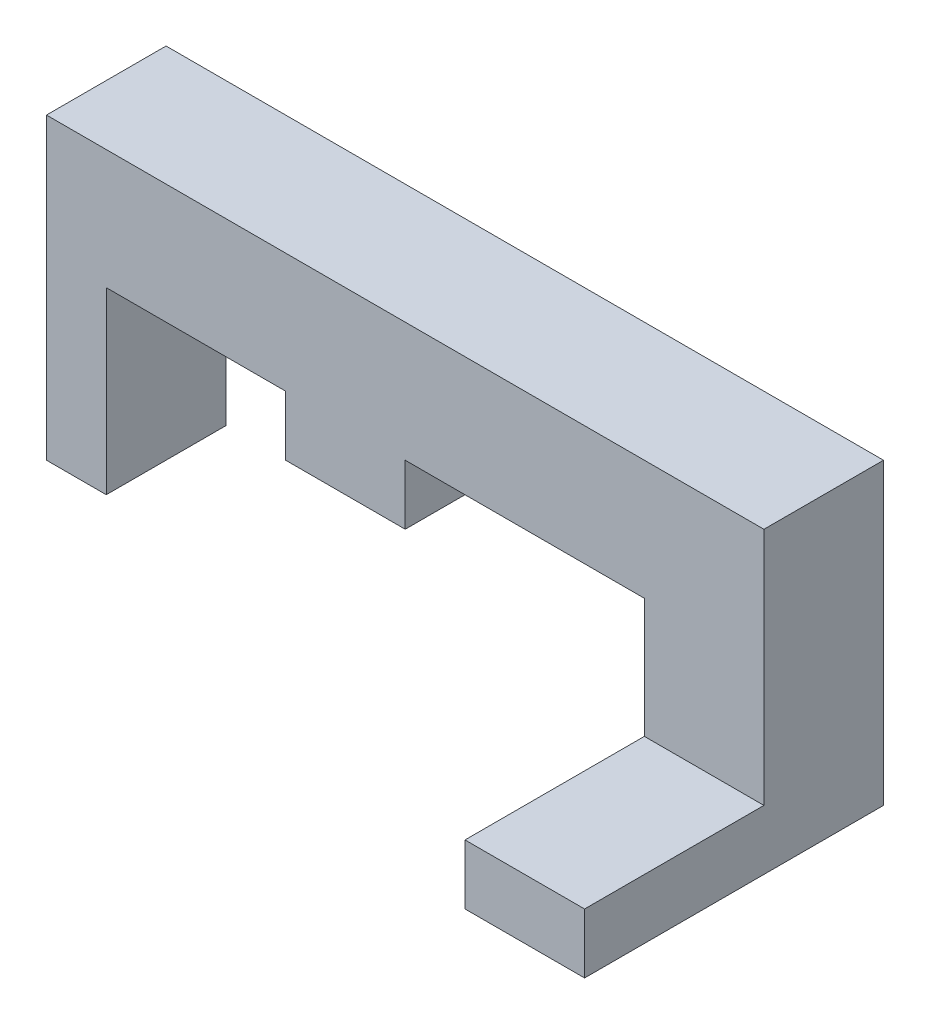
SolidWorks part; units mm, degrees
ref_plane "Alzado" through (0, 0, 0) normal (0, 0, 1) x (1, 0, 0)
ref_plane "Planta" through (0, 0, 0) normal (0, 1, 0) x (1, 0, 0)
ref_plane "Vista lateral" through (0, 0, 0) normal (1, 0, 0) x (0, 0, -1)
sketch "Croquis1" plane through (0, 0, 0) normal (0, 0, 1) x (1, 0, 0)
  line L0 (60, 25) -> (-60, -25) construction
  line L1 (-60, 25) -> (60, 25)
  line L2 (-60, 25) -> (-60, -25)
  line L3 (-60, -25) -> (60, -25)
  line L4 (60, 25) -> (60, -25)
  line L5 (60, -25) -> (-60, 25) construction
  dimension "D1" = 50
  dimension "D2" = 120
extrude "Saliente-Extruir1" add sketch "Croquis1" along normal mid plane 50
sketch "Croquis7" plane through (60, 0, 0) normal (1, 0, 0) x (0, 0, -1)
  line L0 (-25, -25) -> (25, -25) construction
  line L1 (-25, 25) -> (5, 25)
  line L2 (-25, 25) -> (-25, -15)
  line L3 (-25, -15) -> (5, -15)
  line L4 (5, 25) -> (5, -15)
  line L5 (25, -25) -> (25, 25) construction
  dimension "D1" = 10
  dimension "D2" = 20
extrude "Cortar-Extruir6" cut sketch "Croquis7" against normal through all
sketch "Croquis8" plane through (0, 0, -25) normal (0, 0, -1) x (-1, 0, 0)
  line L0 (50, -25) -> (50, 5)
  line L1 (60, -25) -> (-60, -25) construction
  line L2 (50, 5) -> (20, 5)
  line L3 (20, 5) -> (20, -5)
  line L4 (20, -5) -> (0, -5)
  line L5 (0, -5) -> (0, 5)
  line L6 (0, 5) -> (-40, 5)
  line L7 (-40, 5) -> (-40, -25)
  line L8 (-40, -25) -> (50, -25)
  line L9 (60, -15) -> (60, -25) construction
  dimension "D1" = 10
  dimension "D2" = 30
  dimension "D3" = 20
  dimension "D4" = 40
  dimension "D5" = 10
  dimension "D6" = 30
extrude "Cortar-Extruir7" cut sketch "Croquis8" against normal through all
sketch "Croquis9" plane through (0, -15, 0) normal (0, 1, 0) x (1, 0, 0)
  line L4 (-60, -25) -> (-50, -25)
  line L5 (-50, -25) -> (-50, 5)
  line L6 (-50, 5) -> (-60, 5)
  line L7 (-60, 5) -> (-60, -25)
  line L8 (-60, -25) -> (-50, -25)
  line L9 (-50, -25) -> (-50, 5)
  line L10 (-50, 5) -> (-60, 5)
  line L11 (-60, 5) -> (-60, -25)
  dimension "D1" = 0
extrude "Cortar-Extruir8" cut sketch "Croquis9" against normal through all
